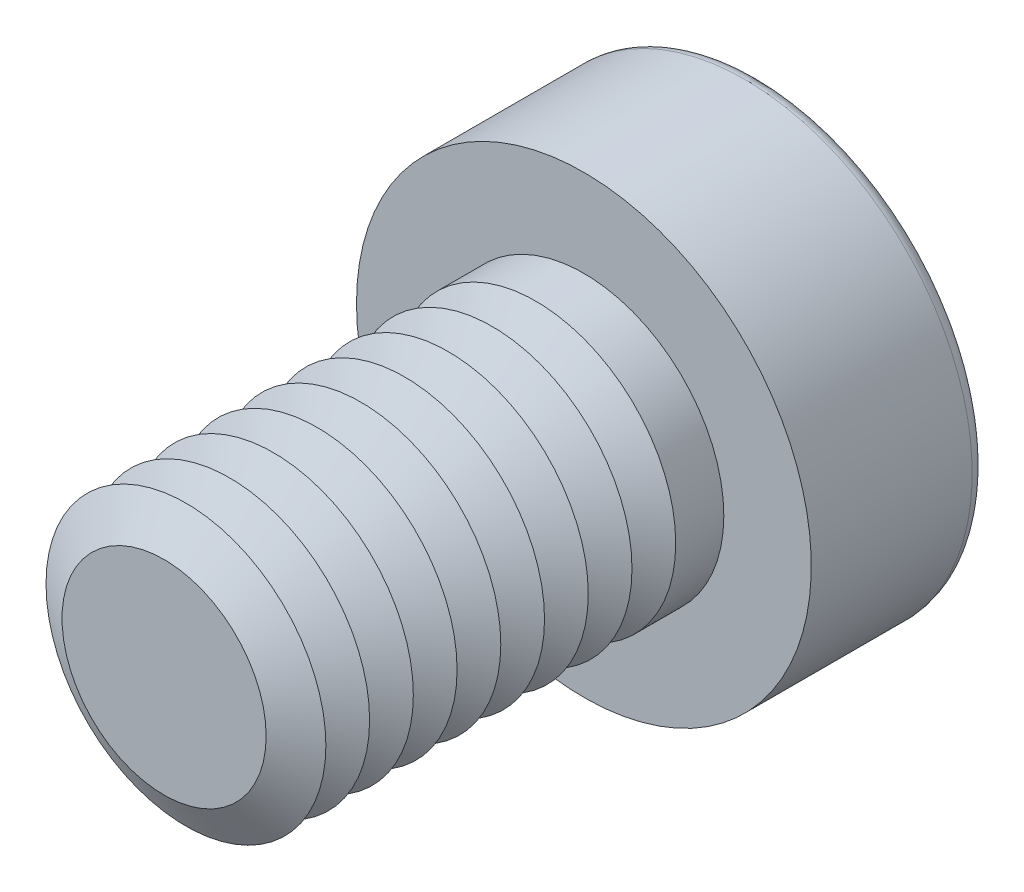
SolidWorks part; units mm, degrees
ref_plane "Front Plane" through (0, 0, 0) normal (0, 0, 1) x (1, 0, 0)
ref_plane "Top Plane" through (0, 0, 0) normal (0, 1, 0) x (1, 0, 0)
ref_plane "Right Plane" through (0, 0, 0) normal (1, 0, 0) x (0, 0, -1)
sketch "Sketch1" plane through (0, 0, 0) normal (0, 0, 1) x (1, 0, 0)
  circle A0 centre (0, 0) radius 4
  dimension "D1" = 8
extrude "Boss-Extrude1" add sketch "Sketch1" along normal blind 12
sketch "Sketch2" plane through (0, 0, 0) normal (0, 0, -1) x (-1, 0, 0)
  circle A0 centre (0, 0) radius 6.5
  dimension "D1" = 13
extrude "Boss-Extrude2" add sketch "Sketch2" along normal blind 5
sketch "Sketch3" plane through (0, 0, -5) normal (0, 0, -1) x (-1, 0, 0)
  line L1 (-1.4434, 2.5) -> (-2.8868, 0)
  line L2 (-2.8868, 0) -> (-1.4434, -2.5)
  line L3 (-1.4434, -2.5) -> (1.4434, -2.5)
  line L4 (1.4434, -2.5) -> (2.8868, 0)
  line L5 (2.8868, 0) -> (1.4434, 2.5)
  line L6 (1.4434, 2.5) -> (-1.4434, 2.5)
  circle A0 centre (0, 0) radius 2.5 construction
  dimension "D1" = 5
extrude "Cut-Extrude1" cut sketch "Sketch3" against normal blind 3.75
fillet "Fillet1" radius 0.4 1 edges at (-6.5, 0, -5)
sketch "Sketch4" plane through (0, 0, -1.25) normal (0, 0, -1) x (-1, 0, 0)
  line L0 (1.4434, -2.5) -> (2.8868, 0) construction
  circle A0 centre (0, 0) radius 2.5
extrude "Cut-Extrude2" cut sketch "Sketch4" against normal through all draft 60
sketch "Sketch5" plane through (0, 0, -5) normal (0, 0, -1) x (-1, 0, 0)
  circle A0 centre (0, 0) radius 2.8868
extrude "Cut-Extrude3" cut sketch "Sketch5" against normal through all draft 75
sketch "Sketch7" plane through (0, 0, 0) normal (1, 0, 0) x (0, 0, -1)
  line L25 (-12, 2.9175) -> (-11.375, 4)
  line L26 (-12, 4) -> (-12, -4) construction
  line L27 (-11.375, 4) -> (-12.625, 4)
  line L28 (-12.625, 4) -> (-12, 2.9175)
  line L29 (0, 4) -> (-12, 4) construction
  dimension "D1" = 1.25
revolve "Cut-Revolve1" cut sketch "Sketch7" angle 360 about axis through (0, 0, 12) along (0, 0, -1)
pattern_linear "LPattern1" count 9 spacing 1.25 along (0, 0, -1) of "Cut-Revolve1"
